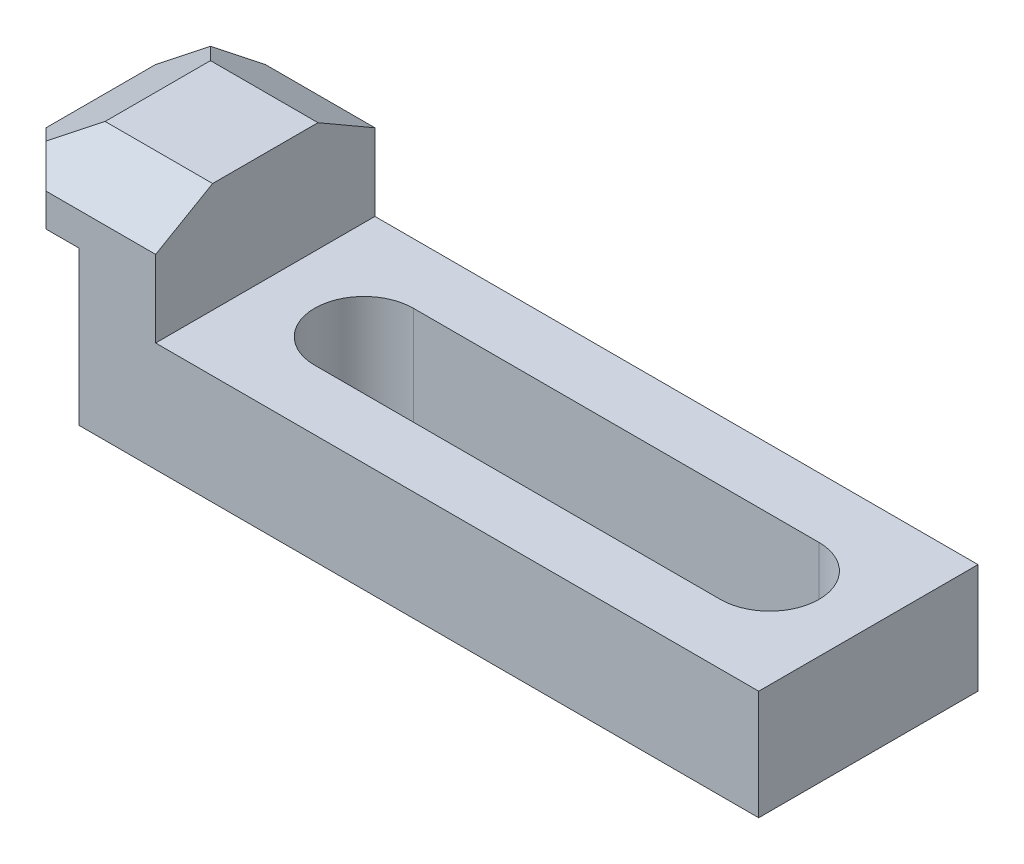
SolidWorks part; units mm, degrees
ref_plane "Front Plane" through (0, 0, 0) normal (0, 0, 1) x (1, 0, 0)
ref_plane "Top Plane" through (0, 0, 0) normal (0, 1, 0) x (1, 0, 0)
ref_plane "Right Plane" through (0, 0, 0) normal (1, 0, 0) x (0, 0, -1)
sketch "Sketch1" plane through (0, 0, 0) normal (0, 0, 1) x (1, 0, 0)
  line L0 (0, 0) -> (8, 0)
  line L1 (8, 0) -> (8, -14)
  line L2 (8, -14) -> (70, -14)
  line L3 (70, -14) -> (70, -4)
  line L4 (70, -4) -> (15, -4)
  line L5 (15, -4) -> (15, 6)
  line L6 (15, 6) -> (0, 6)
  line L7 (0, 6) -> (0, 0)
  dimension "D1" = 8
  dimension "D2" = 14
  dimension "D3" = 70
  dimension "D4" = 15
  dimension "D5" = 10
  dimension "D6" = 20
extrude "Extrude1" add sketch "Sketch1" along normal mid plane 20
chamfer "Chamfer1" distance 3 angle 60 4 edges at (7.5, 6, -10) (0, 6, 0) (7.5, 6, 10) (15, 6, 0)
sketch "Sketch2" plane through (0, -14, 0) normal (0, -1, 0) x (1, 0, 0)
  line L0 (0, 0) -> (50000, 0) construction
  line L1 (24, 4.5) -> (61, 4.5)
  line L2 (0, 10) -> (5, 10)
  line L4 (5, 10) -> (0, 5)
  line L5 (0, 10) -> (0, -10) construction
  line L6 (0, 5) -> (0, 10)
  line L7 (24, -4.5) -> (61, -4.5)
  line L8 (0, -5) -> (0, -10)
  line L9 (5, -10) -> (0, -5)
  line L10 (0, -10) -> (5, -10)
  arc A0 (24, 4.5) -> (24, -4.5) centre (24, 0) ccw
  arc A1 (61, -4.5) -> (61, 4.5) centre (61, 0) ccw
  point P18 (19.5, 0)
  point P19 (65.5, 0)
  dimension "D1" = 45
  dimension "D2" = 10
  dimension "D3" = 19.5
  dimension "D4" = 9
  dimension "D5" = 46
extrude "Extrude2" cut sketch "Sketch2" against normal through all
